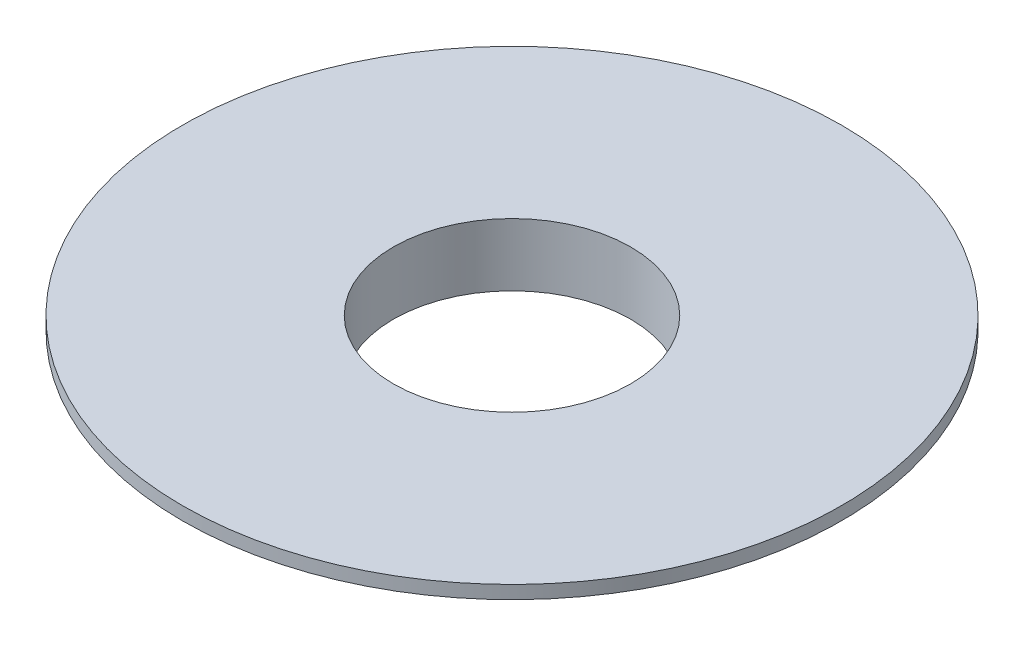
SolidWorks part; units mm, degrees
ref_plane "Plan de face" through (0, 0, 0) normal (0, 0, 1) x (1, 0, 0)
ref_plane "Plan de dessus" through (0, 0, 0) normal (0, 1, 0) x (1, 0, 0)
ref_plane "Plan de droite" through (0, 0, 0) normal (1, 0, 0) x (0, 0, -1)
ref_plane "Plan4" through (0, 0, 0) normal (0, 0, -1) x (-1, 0, 0)
sketch "Esquisse1" plane through (0, 0, 0) normal (0, 0, -1) x (-1, 0, 0)
  line L0 (-22, -6.8375) -> (-22, -14.3375)
  line L1 (-22, -14.3375) -> (-18, -14.3375)
  line L2 (-18, -14.3375) -> (-18, -4.8375)
  line L3 (-18, -4.8375) -> (-50, -4.8375)
  line L4 (-50, -4.8375) -> (-50, -6.8375)
  line L5 (-50, -6.8375) -> (-22, -6.8375)
  line L6 (0, -14.3375) -> (0, -4.8375) construction
  dimension "D1" = 18
revolve "Révolution1" add sketch "Esquisse1" angle 360 about L6
